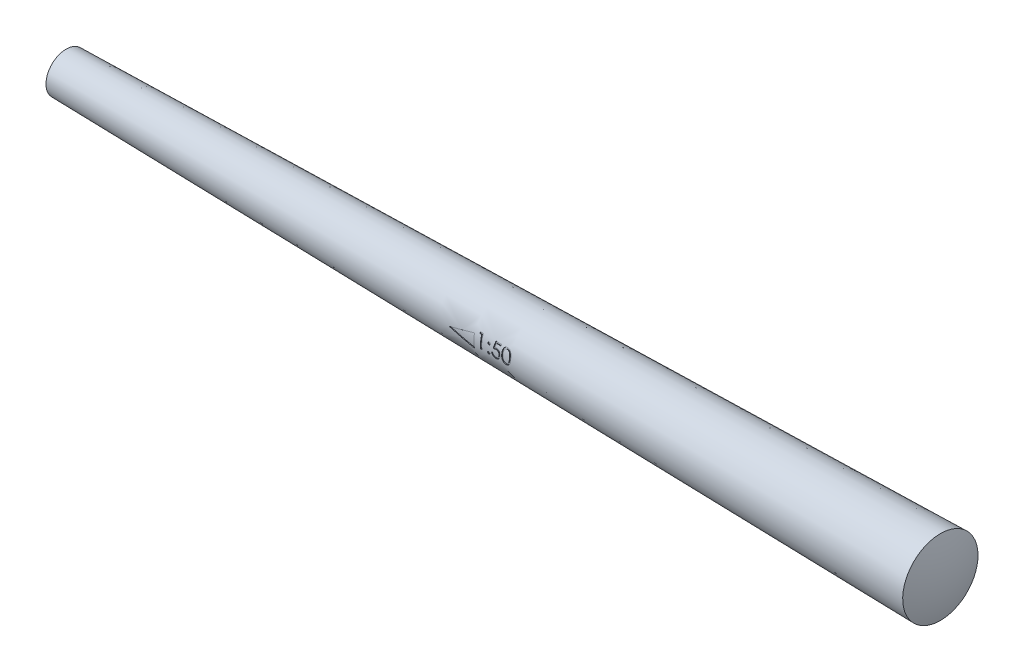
SolidWorks part; units mm, degrees
ref_plane "Front Plane" through (0, 0, 0) normal (0, 0, 1) x (1, 0, 0)
ref_plane "Top Plane" through (0, 0, 0) normal (0, 1, 0) x (1, 0, 0)
ref_plane "Right Plane" through (0, 0, 0) normal (1, 0, 0) x (0, 0, -1)
sketch "Sketch1" plane through (0, 0, 0) normal (1, 0, 0) x (0, 0, -1)
  circle A0 centre (0, 0) radius 1.5
  dimension "D1" = 3
extrude "Extrude1" add sketch "Sketch1" along normal mid plane 65
draft "Draft1" type of draft neutral plane draft angle 1.146 faces to draft 1 parameters "D1"=1.146
sketch "Sketch2" plane through (0, 0, 0) normal (0, 0, 1) x (1, 0, 0)
  line L0 (-32.5, 0) -> (-32.5, 1.5)
  line L1 (-32.5, 1.5) -> (-32.5, -1.5) construction
  line L2 (-32.5, 0) -> (-32.95, 0)
  line L3 (-32.95, 0) -> (-32.95, -2.15) construction
  line L4 (32.5, 0) -> (32.5, 2.8)
  line L5 (32.5, -2.8) -> (32.5, 2.8) construction
  line L6 (32.5, 0) -> (32.95, 0)
  line L7 (32.95, 0) -> (32.95, -2.15) construction
  line L8 (-32.5, -1.5) -> (32.5, -2.8) construction
  arc A0 (-32.95, 0) -> (-32.5, 1.5) centre (-30.225, 0) cw
  arc A1 (32.95, 0) -> (32.5, 2.8) centre (24.0136, 0) ccw
  point P14 (0, -2.15)
revolve "Revolve1" add sketch "Sketch2" angle 360 about L2
sketch "Sketch5" plane through (0, 0, 0) normal (0, 0, 1) x (1, 0, 0)
  line L0 (0, 2.15) -> (0, -2.15) construction
  line L1 (32.5, 2.8) -> (-32.5, 1.5) construction
  line L2 (-32.5, -1.5) -> (32.5, -2.8) construction
ref_plane "Plane2" through (0, 0, 0) normal (-0.02, 0, 0.9998) x (0.9998, 0, 0.02)
sketch "Sketch6" plane through (0, 0, 0) normal (-0.02, 0, 0.9998) x (0.9998, 0, 0.02)
  line L0 (0, 0) -> (0, 0.5)
  line L1 (0, 2.15) -> (0, -2.15) construction
  line L2 (0, 0.5) -> (-1.866, 0)
  line L3 (-1.866, 0) -> (0, -0.5)
  line L4 (0, -0.5) -> (0, 0)
  line L5 (0, -0.25) -> (3, -0.25) construction
  text T0 "1:50" font "Century Gothic" height 1
  dimension "D1" = 1
  dimension "D2" = 30
  dimension "D3" = 3
wrap "Wrap2" sketch "Sketch6" wrap type deboss source sketch "Sketch6" thickness 0.05 parameters "D1"=0.05
equation "\"D2@Sketch2\" = \"D1@Sketch2\""
